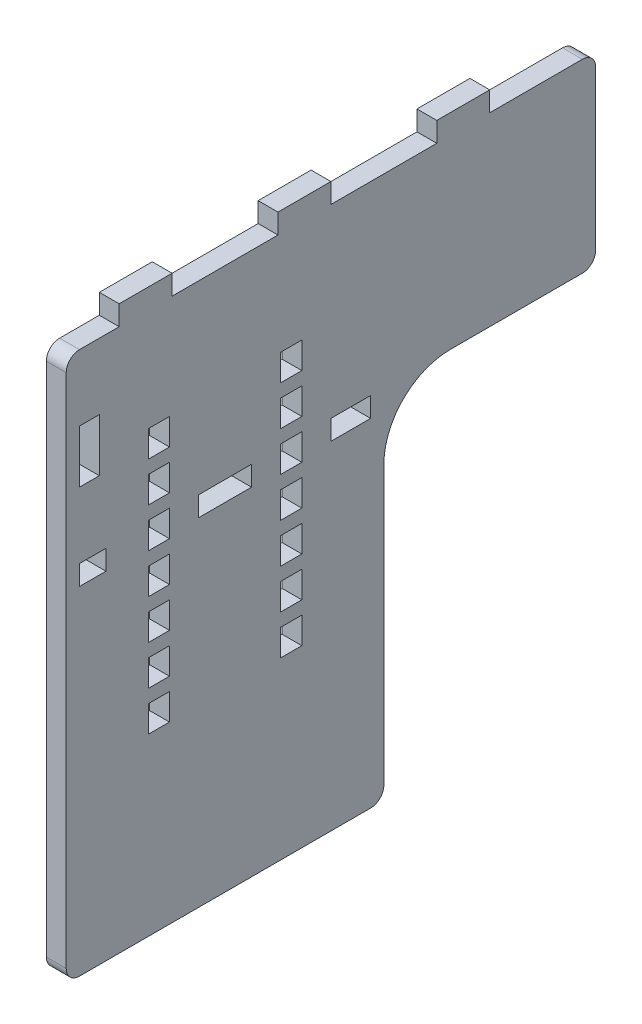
SolidWorks part; units mm, degrees
ref_plane "Alzado" through (0, 0, 0) normal (0, 0, 1) x (1, 0, 0)
ref_plane "Planta" through (0, 0, 0) normal (0, 1, 0) x (1, 0, 0)
ref_plane "Vista lateral" through (0, 0, 0) normal (1, 0, 0) x (0, 0, -1)
sketch "Croquis1" plane through (0, 0, 0) normal (1, 0, 0) x (0, 0, -1)
  line L0 (0, 0) -> (0, 410)
  line L1 (0, 410) -> (400, 410)
  line L2 (400, 410) -> (400, 270)
  line L3 (400, 270) -> (240, 270)
  line L4 (240, 270) -> (240, 0)
  line L5 (240, 0) -> (0, 0)
  dimension "D1" = 240
  dimension "D2" = 410
  dimension "D3" = 400
  dimension "D4" = 140
extrude "Saliente-Extruir1" add sketch "Croquis1" along normal blind 15
fillet "Redondeo1" radius 50 1 edges at (7.5, 270, -240)
sketch "Croquis2" plane through (0, 0, 0) normal (1, 0, 0) x (0, 0, -1)
  line L0 (120, 0) -> (120, 410) construction
  line L1 (0, 0) -> (240, 0) construction
  line L2 (400, 410) -> (0, 410) construction
  line L4 (162, 332.2931) -> (178, 332.2931)
  line L5 (162, 332.2931) -> (162, 312.2931)
  line L6 (162, 312.2931) -> (178, 312.2931)
  line L7 (178, 332.2931) -> (178, 312.2931)
  line L8 (162, 332.2931) -> (178, 312.2931) construction
  line L9 (162, 312.2931) -> (178, 332.2931) construction
  line L10 (162, 302.2931) -> (178, 302.2931)
  line L11 (162, 302.2931) -> (162, 282.2931)
  line L12 (162, 282.2931) -> (178, 282.2931)
  line L13 (178, 302.2931) -> (178, 282.2931)
  line L14 (162, 302.2931) -> (178, 282.2931) construction
  line L15 (162, 282.2931) -> (178, 302.2931) construction
  line L16 (162, 272.2931) -> (178, 272.2931)
  line L17 (162, 272.2931) -> (162, 252.2931)
  line L18 (162, 252.2931) -> (178, 252.2931)
  line L19 (178, 272.2931) -> (178, 252.2931)
  line L20 (162, 272.2931) -> (178, 252.2931) construction
  line L21 (162, 252.2931) -> (178, 272.2931) construction
  line L22 (162, 242.2931) -> (178, 242.2931)
  line L23 (162, 242.2931) -> (162, 222.2931)
  line L24 (162, 222.2931) -> (178, 222.2931)
  line L25 (178, 242.2931) -> (178, 222.2931)
  line L26 (162, 242.2931) -> (178, 222.2931) construction
  line L27 (162, 222.2931) -> (178, 242.2931) construction
  line L28 (162, 212.2931) -> (178, 212.2931)
  line L29 (162, 212.2931) -> (162, 192.2931)
  line L30 (162, 192.2931) -> (178, 192.2931)
  line L31 (178, 212.2931) -> (178, 192.2931)
  line L32 (162, 212.2931) -> (178, 192.2931) construction
  line L33 (162, 192.2931) -> (178, 212.2931) construction
  line L34 (162, 182.2931) -> (178, 182.2931)
  line L35 (162, 182.2931) -> (162, 162.2931)
  line L36 (162, 162.2931) -> (178, 162.2931)
  line L37 (178, 182.2931) -> (178, 162.2931)
  line L38 (162, 182.2931) -> (178, 162.2931) construction
  line L39 (162, 162.2931) -> (178, 182.2931) construction
  line L40 (162, 152.2931) -> (178, 152.2931)
  line L41 (162, 152.2931) -> (162, 132.2931)
  line L42 (162, 132.2931) -> (178, 132.2931)
  line L43 (178, 152.2931) -> (178, 132.2931)
  line L44 (162, 152.2931) -> (178, 132.2931) construction
  line L45 (162, 132.2931) -> (178, 152.2931) construction
  line L46 (62, 332.2931) -> (78, 332.2931)
  line L47 (62, 332.2931) -> (62, 312.2931)
  line L48 (62, 312.2931) -> (78, 312.2931)
  line L49 (78, 332.2931) -> (78, 312.2931)
  line L50 (62, 302.2931) -> (78, 302.2931)
  line L51 (62, 302.2931) -> (62, 282.2931)
  line L52 (62, 282.2931) -> (78, 282.2931)
  line L53 (78, 302.2931) -> (78, 282.2931)
  line L54 (62, 272.2931) -> (78, 272.2931)
  line L55 (62, 272.2931) -> (62, 252.2931)
  line L56 (62, 252.2931) -> (78, 252.2931)
  line L57 (78, 272.2931) -> (78, 252.2931)
  line L58 (62, 242.2931) -> (78, 242.2931)
  line L59 (62, 242.2931) -> (62, 222.2931)
  line L60 (62, 222.2931) -> (78, 222.2931)
  line L61 (78, 242.2931) -> (78, 222.2931)
  line L62 (62, 212.2931) -> (78, 212.2931)
  line L63 (62, 212.2931) -> (62, 192.2931)
  line L64 (62, 192.2931) -> (78, 192.2931)
  line L65 (78, 212.2931) -> (78, 192.2931)
  line L66 (62, 182.2931) -> (78, 182.2931)
  line L67 (62, 182.2931) -> (62, 162.2931)
  line L68 (62, 162.2931) -> (78, 162.2931)
  line L69 (78, 182.2931) -> (78, 162.2931)
  line L70 (78, 152.2931) -> (62, 152.2931)
  line L71 (78, 152.2931) -> (78, 132.2931)
  line L72 (78, 132.2931) -> (62, 132.2931)
  line L73 (62, 152.2931) -> (62, 132.2931)
  point P26 (170, 322.2931)
  dimension "D3" = 50
  dimension "D4" = 16
  dimension "D5" = 20
  dimension "D6" = 20
  dimension "D7" = 20
  dimension "D8" = 16
  dimension "D9" = 16
  dimension "D10" = 20
  dimension "D11" = 16
  dimension "D12" = 50
  dimension "D13" = 16
  dimension "D14" = 20
  dimension "D15" = 58
  dimension "D16" = 58
  dimension "D17" = 16
  dimension "D18" = 16
  dimension "D19" = 20
  dimension "D20" = 20
  dimension "D21" = 58
  dimension "D22" = 58
  dimension "D23" = 58
  dimension "D24" = 58
  dimension "D25" = 16
  dimension "D26" = 16
  dimension "D27" = 16
  dimension "D28" = 16
  dimension "D29" = 16
  dimension "D30" = 16
  dimension "D31" = 16
  dimension "D32" = 42
  dimension "D33" = 42
  dimension "D34" = 42
  dimension "D35" = 42
  dimension "D36" = 42
  dimension "D37" = 42
  dimension "D38" = 42
  dimension "D39" = 10
extrude "Cortar-Extruir3" cut sketch "Croquis2" along normal through all contours L29 L28 L31 L30 | L35 L34 L37 L36 | L41 L40 L43 L42 | L23 L22 L25 L24 | L17 L16 L19 L18 | L11 L10 L13 L12 | L5 L4 L7 L6 | L47 L46 L49 L48 | L51 L50 L53 L52 | L55 L54 L57 L56 | L59 L58 L61 L60 | L63 L62 L65 L64 | L67 L66 L69 L68 | L71 L70 L73 L72
fillet "Redondeo2" radius 10 5 edges at (7.5, 0, -240) (7.5, 0, 0) (7.5, 410, 0) (7.5, 410, -400) (7.5, 270, -400)
sketch "Croquis3" plane through (0, 0, 0) normal (0, 1, 0) x (1, 0, 0)
  line L0 (0, 390) -> (0, 10) construction
  line L1 (0, 320) -> (15, 320)
  line L2 (0, 320) -> (0, 280)
  line L3 (0, 280) -> (15, 280)
  line L4 (15, 320) -> (15, 280)
  line L5 (15, 390) -> (15, 10) construction
  line L6 (7.5, 390) -> (7.5, 0) construction
  line L7 (0, 80) -> (15, 80)
  line L8 (0, 80) -> (0, 40)
  line L9 (0, 40) -> (15, 40)
  line L10 (15, 80) -> (15, 40)
  line L11 (0, 200) -> (15, 200)
  line L12 (0, 200) -> (0, 160)
  line L13 (0, 160) -> (15, 160)
  line L14 (15, 200) -> (15, 160)
  line L15 (0, 10) -> (15, 10) construction
  line L16 (15, 390) -> (0, 390) construction
  point P22 (15, 300)
  dimension "D1" = 40
  dimension "D2" = 40
  dimension "D3" = 40
  dimension "D4" = 30
extrude "Saliente-Extruir2" add sketch "Croquis3" along normal blind 15 from offset 410
sketch "Croquis4" plane through (0, 0, 0) normal (1, 0, 0) x (0, 0, -1)
  line L0 (10, 380.3285) -> (10, 198.1104) construction
  line L1 (0, 400) -> (0, 10) construction
  line L2 (40, 410) -> (10, 410) construction
  line L3 (10, 360) -> (25, 360)
  line L4 (10, 360) -> (10, 320)
  line L5 (10, 320) -> (25, 320)
  line L6 (25, 360) -> (25, 320)
  dimension "D1" = 10
  dimension "D2" = 50
  dimension "D3" = 15
  dimension "D4" = 40
extrude "Cortar-Extruir4" cut sketch "Croquis4" along normal blind 15
sketch "Croquis5" plane through (0, 0, 0) normal (1, 0, 0) x (0, 0, -1)
  line L0 (120, 343.575) -> (120, 70.1783) construction
  line L1 (78, 332.2931) -> (78, 312.2931) construction
  line L2 (160, 410) -> (80, 410) construction
  line L3 (100, 270) -> (140, 270)
  line L4 (100, 270) -> (100, 255)
  line L5 (100, 255) -> (140, 255)
  line L6 (140, 270) -> (140, 255)
  line L7 (100, 270) -> (140, 255) construction
  line L8 (100, 255) -> (140, 270) construction
  line L9 (78, 272.2931) -> (78, 252.2931) construction
  point P4 (120, 262.5)
  dimension "D1" = 42
  dimension "D2" = 140
  dimension "D3" = 15
  dimension "D4" = 40
extrude "Cortar-Extruir5" cut sketch "Croquis5" along normal blind 15
sketch "Croquis6" plane through (0, 0, 0) normal (1, 0, 0) x (0, 0, -1)
  line L0 (0, 400) -> (0, 10) construction
  line L1 (10, 270) -> (30, 270)
  line L2 (10, 270) -> (10, 255)
  line L3 (10, 255) -> (30, 255)
  line L4 (30, 270) -> (30, 255)
  dimension "D1" = 20
  dimension "D2" = 10
extrude "Cortar-Extruir6" cut sketch "Croquis6" along normal blind 20
sketch "Croquis7" plane through (0, 0, 0) normal (1, 0, 0) x (0, 0, -1)
  line L0 (140, 255) -> (140, 270) construction
  line L1 (200, 270) -> (230, 270)
  line L2 (200, 270) -> (200, 255)
  line L3 (200, 255) -> (230, 255)
  line L4 (230, 270) -> (230, 255)
  dimension "D1" = 60
  dimension "D2" = 30
extrude "Cortar-Extruir7" cut sketch "Croquis7" along normal blind 15
